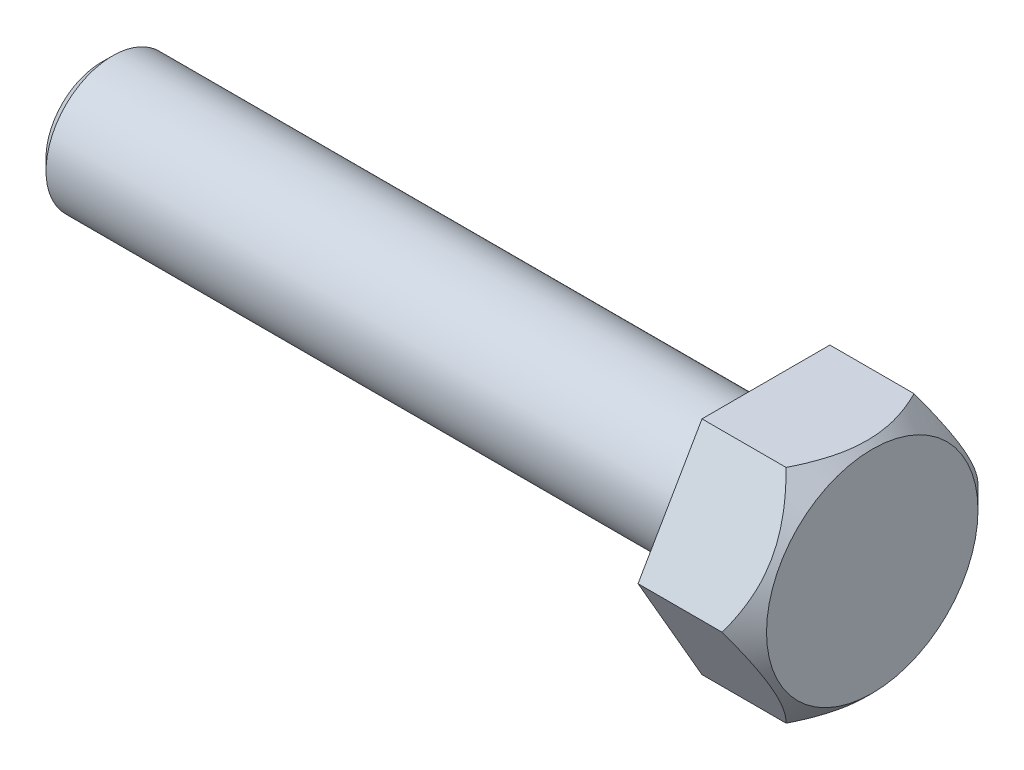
SolidWorks part; units mm, degrees
ref_plane "Plane1" through (0, 0, 0) normal (0, 0, 1) x (1, 0, 0)
ref_plane "Plane2" through (0, 0, 0) normal (0, 1, 0) x (1, 0, 0)
ref_plane "Plane3" through (0, 0, 0) normal (1, 0, 0) x (0, 0, -1)
sketch "Esquisse4" plane through (0, 0, 0) normal (1, 0, 0) x (0, 0, -1)
  circle A0 centre (0, 0) radius 3
  dimension "D1" = 6
extrude "Base-Extrusion" add sketch "Esquisse4" against normal blind 30
sketch "Esquisse7" plane through (0, 0, 0) normal (1, 0, 0) x (0, 0, -1)
  line L0 (-2.8868, 5) -> (2.8868, 5)
  line L1 (2.8868, 5) -> (5.7735, 0)
  line L2 (-2.8868, 5) -> (-5.7735, 0)
  line L3 (-2.8868, -5) -> (2.8868, -5)
  line L4 (5.7735, 0) -> (2.8868, -5)
  line L5 (-5.7735, 0) -> (-2.8868, -5)
  line L6 (0, 0) -> (6.308, 0) construction
  dimension "D2" = 120
  dimension "D3" = 120
  dimension "D4" = 120
  dimension "D5" = 120
  dimension "D6" = 120
extrude "Bossage-Extrusion1" add sketch "Esquisse7" along normal blind 4.8
chamfer "Chanfrein1" distance 0.5 angle 45
sketch "Esquisse12" plane through (0, 0, 0) normal (0, 1, 0) x (1, 0, 0)
  line L0 (4.8, 5.7735) -> (3.8, 5.7735)
  line L1 (4.8, 5.7735) -> (0, 5.7735) construction
  line L2 (3.8, 5.7735) -> (4.8, 4.7735)
  line L3 (4.8, 2.8868) -> (4.8, 5.7735) construction
  line L4 (4.8, 4.7735) -> (4.8, 5.7735)
  dimension "D1" = 1
  dimension "D2" = 1
sketch "Esquisse13" plane through (4.8, 0, 0) normal (1, 0, 0) x (0, 0, -1)
  circle A0 centre (0, 0) radius 5
  dimension "D1" = 10
sweep "Couper-Balayage2" cut profiles "Esquisse12" path "Esquisse13"
